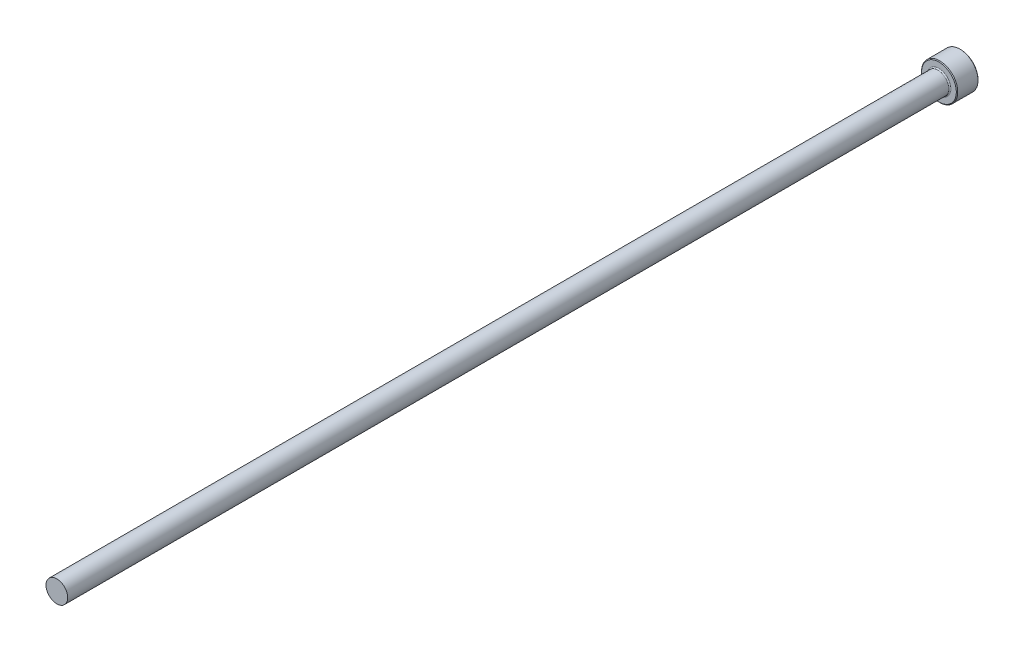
SolidWorks part; units mm, degrees
ref_plane "Front Plane" through (0, 0, 0) normal (0, 0, 1) x (1, 0, 0)
ref_plane "Top Plane" through (0, 0, 0) normal (0, 1, 0) x (1, 0, 0)
ref_plane "Right Plane" through (0, 0, 0) normal (1, 0, 0) x (0, 0, -1)
sketch "Sketch1" plane through (0, 0, 0) normal (1, 0, 0) x (0, 0, -1)
  line L0 (0, 0) -> (0, 5)
  line L1 (0, 5.5) -> (0, -5.5) construction
  line L2 (0, 5) -> (-6, 5)
  line L3 (-6, 5) -> (-6, 3.3)
  line L4 (-6.3, 3) -> (-250, 3)
  line L5 (-250, 3) -> (-250, 0)
  line L6 (5.5, 0) -> (-5.5, 0) construction
  line L7 (-250, 0) -> (0, 0)
  line L8 (-109.0506, 0) -> (16.9928, 0) construction
  arc A0 (-6, 3.3) -> (-6.3, 3) centre (-6.3, 3.3) cw
  dimension "D1" = 0.3
  dimension "D2" = 10
  dimension "D3" = 6
  dimension "D4" = 250
  dimension "D5" = 6
revolve "Revolve1" add sketch "Sketch1" angle 360 about L8
chamfer "Chamfer1" distance 0.2 angle 45 2 edges at (5, 0, 0) (5, 0, 6)
